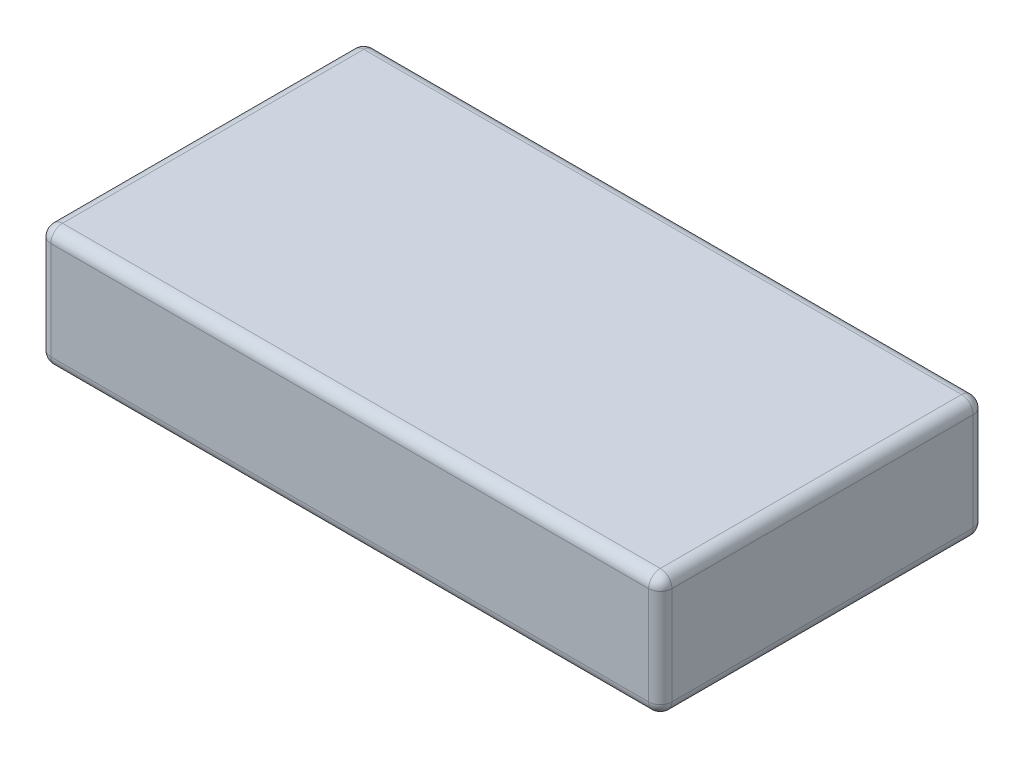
SolidWorks part; units mm, degrees
ref_plane "前视基准面" through (0, 0, 0) normal (0, 0, 1) x (1, 0, 0)
ref_plane "上视基准面" through (0, 0, 0) normal (0, 1, 0) x (1, 0, 0)
ref_plane "右视基准面" through (0, 0, 0) normal (1, 0, 0) x (0, 0, -1)
other "Configuration Table"
sketch "草图1" plane through (0, 0, 0) normal (0, 1, 0) x (1, 0, 0)
  line L1 (-26.6, -13.9) -> (26.6, -13.9)
  line L2 (-26.6, -13.9) -> (-26.6, 13.9)
  line L3 (-26.6, 13.9) -> (26.6, 13.9)
  line L4 (26.6, -13.9) -> (26.6, 13.9)
  line L5 (-26.6, -13.9) -> (26.6, 13.9) construction
  line L6 (-26.6, 13.9) -> (26.6, -13.9) construction
  point P0 (0, 0)
  dimension "D1" = 53.2
  dimension "D2" = 27.8
extrude "凸台-拉伸1" add sketch "草图1" along normal blind 10.4
fillet "圆角1" radius 1 12 edges at (0, 0, -13.9) (-26.6, 0, 0) (0, 0, 13.9) (26.6, 0, 0) (0, 10.4, 13.9) (-26.6, 10.4, 0) (0, 10.4, -13.9) (26.6, 10.4, 0) (-26.6, 5.2, 13.9) (-26.6, 5.2, -13.9) (26.6, 5.2, -13.9) (26.6, 5.2, 13.9)
